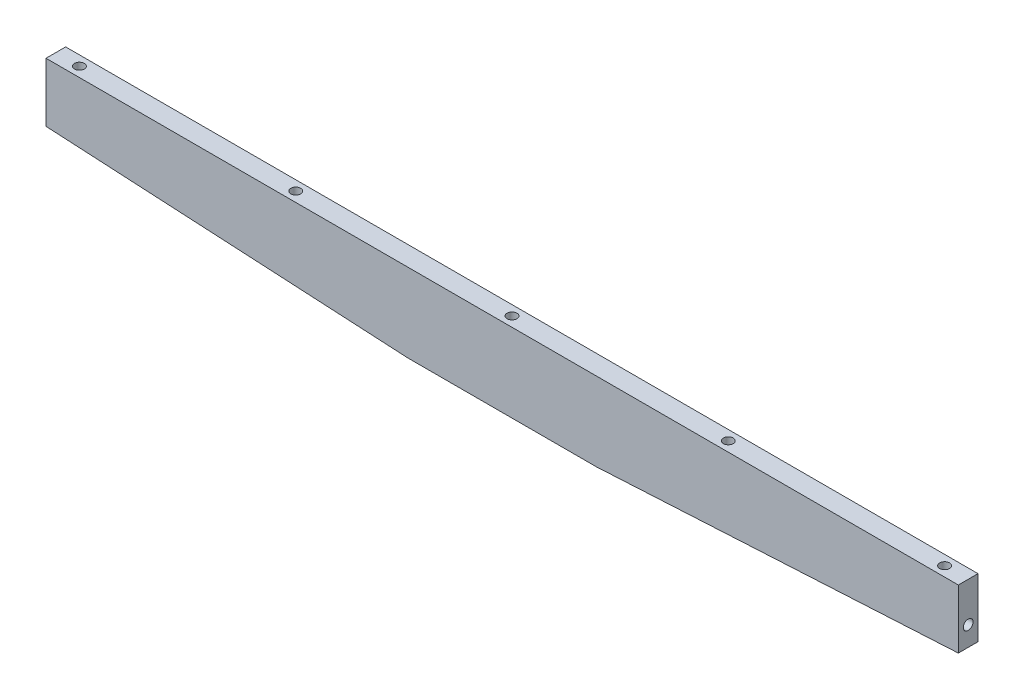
SolidWorks part; units mm, degrees
ref_plane "Front Plane" through (0, 0, 0) normal (0, 0, 1) x (1, 0, 0)
ref_plane "Top Plane" through (0, 0, 0) normal (0, 1, 0) x (1, 0, 0)
ref_plane "Right Plane" through (0, 0, 0) normal (1, 0, 0) x (0, 0, -1)
sketch "Sketch1" plane through (0, 0, 0) normal (0, 0, 1) x (1, 0, 0)
  line L0 (-1608.0723, 0) -> (78795.543, 0) construction
  line L1 (0, -1608.0723) -> (0, 78795.543) construction
  line L2 (294.64, 0) -> (-294.64, 0)
  line L3 (-294.64, 0) -> (-294.64, -38.1)
  line L4 (-294.64, -38.1) -> (-60.96, -50.8)
  line L5 (-60.96, -50.8) -> (60.96, -50.8)
  line L6 (294.64, -38.1) -> (60.96, -50.8)
  line L7 (294.64, 0) -> (294.64, -38.1)
  point P11 (0, -50.8)
  point P13 (0, 0)
  dimension "D1" = 38.1
  dimension "D2" = 50.8
  dimension "D3" = 589.28
  dimension "D4" = 355.6
extrude "Boss-Extrude1" add sketch "Sketch1" along normal mid plane 12.7
sketch "Sketch2" plane through (0, 0, 0) normal (0, 1, 0) x (1, 0, 0)
  line L0 (0, -1000) -> (0, 49000) construction
  line L1 (-1000, 0) -> (49000, 0) construction
  line L2 (-294.64, -6.35) -> (-294.64, 6.35) construction
  circle A0 centre (-279.4, 0) radius 3.175
  circle A1 centre (-139.7, 0) radius 3.175
  circle A2 centre (0, 0) radius 3.175
  circle A3 centre (139.7, 0) radius 3.175
  circle A4 centre (279.4, 0) radius 3.175
  dimension "D2" = 6.35
  dimension "D1" = 15.24
  dimension "D3" = 5
extrude "Cut-Extrude1" cut sketch "Sketch2" against normal blind 19.05
sketch "Sketch3" plane through (-294.64, 0, 0) normal (-1, 0, 0) x (0, 0, 1)
  line L0 (6.35, 0) -> (-6.35, 0) construction
  circle A0 centre (0, -25.4) radius 3.175
  dimension "D1" = 6.35
  dimension "D2" = 25.4
extrude "Cut-Extrude2" cut sketch "Sketch3" against normal blind 19.05
ref_plane "Plane1" through (0, -42.672, 0) normal (0, 1, 0) x (1, 0, 0)
sketch "Sketch4" plane through (0, -42.672, 0) normal (0, 1, 0) x (1, 0, 0)
  line L0 (294.64, -6.35) -> (294.64, 6.35) construction
  circle A0 centre (250.19, 0) radius 3.175
  dimension "D1" = 6.35
  dimension "D2" = 44.45
extrude "Cut-Extrude3" cut sketch "Sketch4" along normal blind 19.812
mirror "Mirror1" about plane through (0, 0, 0) normal (1, 0, 0) of "Cut-Extrude3", "Cut-Extrude2"
